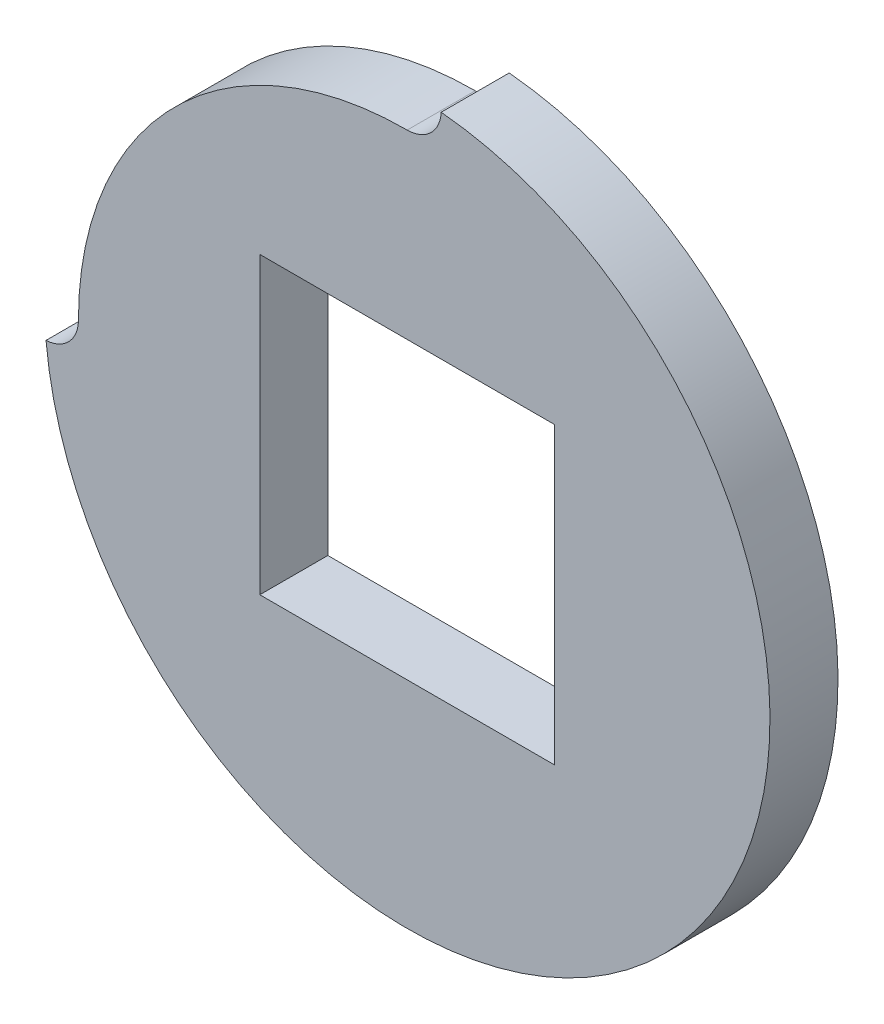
SolidWorks part; units mm, degrees
ref_plane "Plan1" through (0, 0, 0) normal (0, 0, 1) x (1, 0, 0)
ref_plane "Plan2" through (0, 0, 0) normal (0, 1, 0) x (1, 0, 0)
ref_plane "Plan3" through (0, 0, 0) normal (1, 0, 0) x (0, 0, -1)
sketch "Esquisse1" plane through (0, 0, 0) normal (0, 0, 1) x (1, 0, 0)
  line L0 (-6.5, 6.5) -> (6.5, 6.5)
  line L1 (-6.5, 6.5) -> (-6.5, -6.5)
  line L2 (6.5, -6.5) -> (-6.5, -6.5)
  line L3 (6.5, -6.5) -> (6.5, 6.5)
  arc A0 (-15.9297, -1.4984) -> (1.4984, 15.9297) centre (0, 0) ccw
  arc A1 (0, 14.5) -> (-14.5, 0) centre (0, 0) ccw
  arc A2 (0, 14.5) -> (1.4984, 15.9297) centre (0, 16) ccw
  arc A3 (-15.9297, -1.4984) -> (-14.5, 0) centre (-16, 0) ccw
  dimension "D1" = 32
  dimension "D4" = 29
  dimension "D7" = 3
  dimension "D8" = 3
  dimension "D2" = 13
  dimension "D3" = 13
  dimension "D5" = 6.5
  dimension "D6" = 6.5
extrude "Base-Extrusion" add sketch "Esquisse1" along normal blind 3
